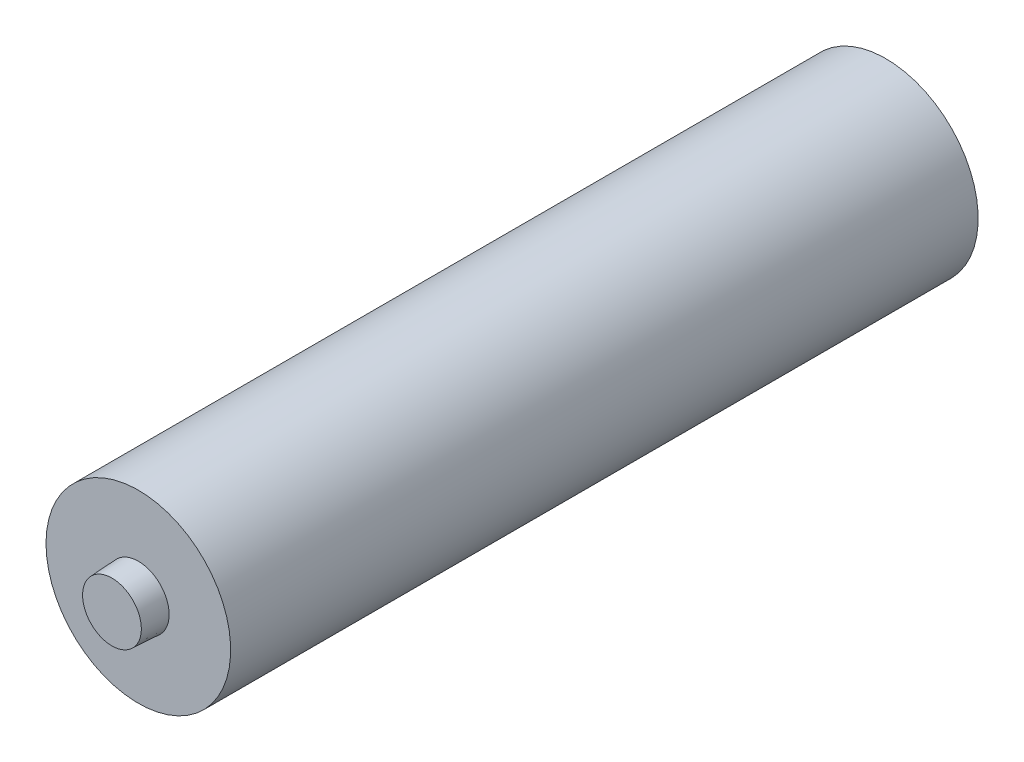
SolidWorks part; units mm, degrees
ref_plane "Face" through (0, 0, 0) normal (0, 0, 1) x (1, 0, 0)
ref_plane "Dessus" through (0, 0, 0) normal (0, 1, 0) x (1, 0, 0)
ref_plane "Droite" through (0, 0, 0) normal (1, 0, 0) x (0, 0, -1)
sketch "Esquisse1" plane through (0, 0, 0) normal (0, 0, 1) x (1, 0, 0)
  circle A0 centre (0, 0) radius 5.25
  dimension "D1" = 10.5
extrude "Extrusion1" add sketch "Esquisse1" along normal blind 42.5
sketch "Esquisse2" plane through (0, 0, 42.5) normal (0, 0, 1) x (1, 0, 0)
  circle A0 centre (0, 0) radius 1.75
  dimension "D1" = 3.5
extrude "Extrusion2" add sketch "Esquisse2" along normal blind 1.5 draft 3
